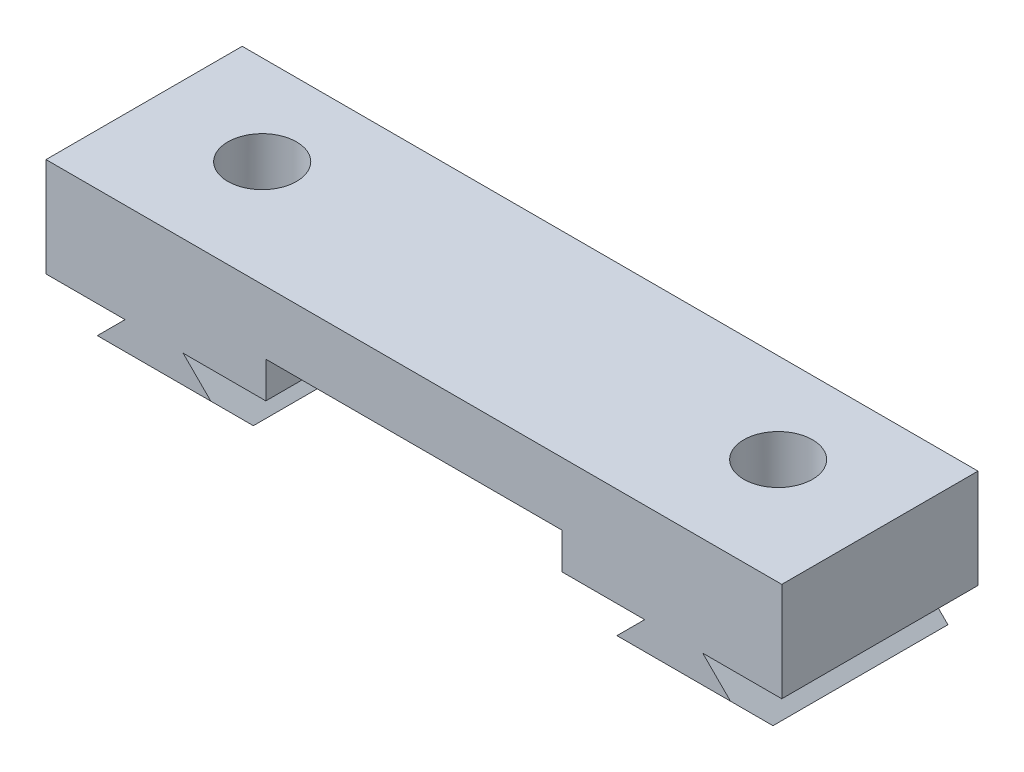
SolidWorks part; units mm, degrees
ref_plane "Front Plane" through (0, 0, 0) normal (0, 0, 1) x (1, 0, 0)
ref_plane "Top Plane" through (0, 0, 0) normal (0, 1, 0) x (1, 0, 0)
ref_plane "Right Plane" through (0, 0, 0) normal (1, 0, 0) x (0, 0, -1)
sketch "Sketch1" plane through (0, 0, 0) normal (0, 1, 0) x (1, 0, 0)
  line L0 (9.0549, 62.1087) -> (22.5, 62.1087) construction
  line L1 (-22.5, -77.5) -> (22.5, -77.5)
  line L2 (-22.5, -77.5) -> (-22.5, 77.5)
  line L3 (-22.5, 77.5) -> (22.5, 77.5)
  line L4 (22.5, -77.5) -> (22.5, 77.5)
  line L5 (-22.5, -77.5) -> (22.5, 77.5) construction
  line L6 (-22.5, 77.5) -> (22.5, -77.5) construction
  line L7 (-9.0549, -71) -> (9.0549, -71)
  line L8 (-9.0549, -71) -> (-9.0549, 71)
  line L9 (-9.0549, 71) -> (9.0549, 71)
  line L10 (9.0549, -71) -> (9.0549, 71)
  line L11 (-9.0549, -71) -> (9.0549, 71) construction
  line L12 (-9.0549, 71) -> (9.0549, -71) construction
  line L13 (22.5, 0) -> (30.5303, 0) construction
  line L14 (0, 71) -> (0, 63.7491) construction
  circle A0 centre (15.7774, 71) radius 2.1
  circle A1 centre (15.7774, -71) radius 2.1
  circle A2 centre (-15.7774, -71) radius 2.1
  circle A3 centre (-15.7774, 71) radius 2.1
  point P0 (0, 0)
  point P6 (0, 0)
  dimension "D4" = 4.2
  dimension "D1" = 45
  dimension "D2" = 155
  dimension "D3" = 142
extrude "Boss-Extrude1" add sketch "Sketch1" along normal blind 3.85
sketch "Sketch2" plane through (22.5, 0, 0) normal (1, 0, 0) x (0, 0, -1)
  line L0 (0, -36.15) -> (0, -37.8485) construction
  line L1 (0, -32.15) -> (-8.9497, -32.15) construction
  line L2 (-60.5001, -2.2123) -> (-12.3944, -2.2123) construction
  line L3 (-60.5001, -0.1123) -> (-12.3944, -0.1123)
  line L4 (-60.5001, -4.3123) -> (-12.3944, -4.3123)
  line L5 (0, 3.85) -> (0, 7.9942) construction
  line L6 (-77.5, 3.85) -> (77.5, 3.85) construction
  line L7 (60.5001, -2.2123) -> (12.3944, -2.2123) construction
  line L8 (60.5001, -0.1123) -> (12.3944, -0.1123)
  line L9 (60.5001, -4.3123) -> (12.3944, -4.3123)
  line L10 (61.6288, -8.735) -> (56.4489, -13.9148)
  line L11 (-10.743, -8.735) -> (-32.1809, -8.735)
  line L12 (-32.1809, -8.735) -> (-15.8727, -25.0432)
  line L13 (-36.07, -8.735) -> (-18.3961, -26.4088)
  line L14 (-18.3961, -26.4088) -> (-36.07, -26.4088)
  line L15 (-36.07, -26.4088) -> (-36.07, -8.735)
  line L16 (-38.82, -8.735) -> (-38.82, -19.7248)
  line L17 (-38.82, -19.7248) -> (-49.8099, -8.735)
  line L18 (-49.8099, -8.735) -> (-38.82, -8.735)
  line L19 (-53.6989, -8.735) -> (-44.5827, -17.8512)
  line L20 (-44.5827, -17.8512) -> (-53.6989, -17.8512)
  line L21 (-53.6989, -17.8512) -> (-53.6989, -8.735)
  line L22 (-56.4489, -13.9148) -> (-56.4489, -8.735)
  line L23 (-56.4489, -8.735) -> (-61.6288, -8.735)
  line L24 (-61.6288, -8.735) -> (-56.4489, -13.9148)
  line L25 (-32.1809, -8.735) -> (-80.3886, -8.735) construction
  line L26 (56.4489, -13.9148) -> (56.4489, -8.735)
  line L27 (53.6989, -17.8512) -> (53.6989, -8.735)
  line L28 (44.5827, -17.8512) -> (53.6989, -17.8512)
  line L29 (53.6989, -8.735) -> (44.5827, -17.8512)
  line L30 (49.8099, -8.735) -> (38.82, -8.735)
  line L31 (38.82, -19.7248) -> (49.8099, -8.735)
  line L32 (38.82, -8.735) -> (38.82, -19.7248)
  line L33 (36.07, -26.4088) -> (36.07, -8.735)
  line L34 (18.3961, -26.4088) -> (36.07, -26.4088)
  line L35 (36.07, -8.735) -> (18.3961, -26.4088)
  line L36 (32.1809, -8.735) -> (15.8727, -25.0432)
  line L37 (10.743, -8.735) -> (32.1809, -8.735)
  line L38 (56.4489, -8.735) -> (61.6288, -8.735)
  circle A0 centre (0, -21.075) radius 11.075
  circle A1 centre (0, -2.2123) radius 2.1
  arc A2 (-60.5001, -0.1123) -> (-60.5001, -4.3123) centre (-60.5001, -2.2123) ccw
  arc A3 (-12.3944, -4.3123) -> (-12.3944, -0.1123) centre (-12.3944, -2.2123) ccw
  arc A4 (60.5001, -0.1123) -> (60.5001, -4.3123) centre (60.5001, -2.2123) cw
  arc A5 (12.3944, -4.3123) -> (12.3944, -0.1123) centre (12.3944, -2.2123) cw
  arc A6 (-10.743, -8.735) -> (-15.8727, -25.0432) centre (0, -21.075) ccw
  arc A7 (10.743, -8.735) -> (15.8727, -25.0432) centre (0, -21.075) cw
  spline S0 degree 3 poles (0, -36.15) (-57.8718, -36.025) (-77.0889, -10.6303) (-77.5, 0) knots 0 0 0 0 1 1 1 1
  spline S1 degree 3 poles (0, -36.15) (57.8718, -36.025) (77.0889, -10.6303) (77.5, 0) knots 0 0 0 0 1 1 1 1
  point P14 (-36.4473, -2.2123)
  point P25 (36.4473, -2.2123)
  dimension "D1" = 22.15
  dimension "D2" = 4.2
  dimension "D4" = 2.1
  dimension "D3" = 4
  dimension "D5" = 45
  dimension "D6" = 45
  dimension "D7" = 45
  dimension "D8" = 2.75
  dimension "D9" = 2.75
  dimension "D10" = 2.75
  dimension "D11" = 2.75
  dimension "D12" = 40
extrude "Boss-Extrude2" add sketch "Sketch2" against normal up to surface (31.5549 mm away) contours S0 S1 L11 A6 L12 L9 A5 L8 A4 L26 L38 L10 L20 L21 L19 L17 L18 L16 L14 L15 L13 L24 L23 L22 L29 L27 L28 L32 L30 L31 L35 L33 L34 A0 A1 A3 L4 M16
mirror "Mirror9" about plane through (0, 0, 0) normal (1, 0, 0) of "Boss-Extrude2"
sketch "Sketch4" plane through (0, 0, 0) normal (0, 1, 0) x (1, 0, 0)
  line L1 (9.0549, 71) -> (-9.0549, 71)
  line L2 (9.0549, 71) -> (9.0549, -71)
  line L3 (9.0549, -71) -> (-9.0549, -71)
  line L4 (-9.0549, 71) -> (-9.0549, -71)
  circle A0 centre (15.7774, -71) radius 2.1
  circle A1 centre (-15.7774, -71) radius 2.1
  circle A2 centre (15.7774, 71) radius 2.1
  circle A3 centre (-15.7774, 71) radius 2.1
extrude "Cut-Extrude1" cut sketch "Sketch4" against normal through all
sketch "Sketch5" plane through (0, 0, 77.5) normal (0, 0, 1) x (1, 0, 0)
  line L0 (-22.5, 0) -> (22.5, 0) construction
  line L1 (-9.0549, -13.0689) -> (9.0549, -13.0689)
  line L2 (-9.0549, -13.0689) -> (-9.0549, 0)
  line L3 (-9.0549, 0) -> (9.0549, 0)
  line L4 (9.0549, -13.0689) -> (9.0549, 0)
extrude "Cut-Extrude2" cut sketch "Sketch5" against normal through all
sketch "Sketch6" plane through (22.5, 0, 0) normal (1, 0, 0) x (0, 0, -1)
  line L0 (-60.5001, -2.2123) -> (-12.3944, -2.2123) construction
  line L1 (-60.5001, 1.3877) -> (-12.3944, 1.3877)
  line L2 (-60.5001, -5.8123) -> (-12.3944, -5.8123)
  line L3 (0, -0.1123) -> (0, -1.2356) construction
  line L4 (60.5001, -2.2123) -> (12.3944, -2.2123) construction
  line L5 (60.5001, 1.3877) -> (12.3944, 1.3877)
  line L6 (60.5001, -5.8123) -> (12.3944, -5.8123)
  arc A0 (-60.5001, 1.3877) -> (-60.5001, -5.8123) centre (-60.5001, -2.2123) ccw
  arc A1 (-12.3944, -5.8123) -> (-12.3944, 1.3877) centre (-12.3944, -2.2123) ccw
  circle A2 centre (0, -2.2123) radius 2.1 construction
  arc A3 (60.5001, 1.3877) -> (60.5001, -5.8123) centre (60.5001, -2.2123) cw
  arc A4 (12.3944, -5.8123) -> (12.3944, 1.3877) centre (12.3944, -2.2123) cw
  point P4 (-36.4473, -2.2123)
  point P16 (36.4473, -2.2123)
  dimension "D1" = 3.6
extrude "Cut-Extrude3" cut sketch "Sketch6" against normal blind 3.5
ref_plane "Plane1" through (0, -35, 0) normal (0, -1, 0) x (-1, 0, 0)
ref_plane "Plane2" through (0, -1.15, 0) normal (0, 1, 0) x (1, 0, 0)
mirror "Mirror10" about plane through (0, 0, 0) normal (1, 0, 0) of "Cut-Extrude3"
sketch "Sketch11" plane through (0, -35, 0) normal (0, -1, 0) x (-1, 0, 0)
  line L0 (0, 77.5) -> (0, 63.1693) construction
  line L1 (15.7774, 75.1569) -> (12.1774, 73.0785)
  line L2 (12.1774, 73.0785) -> (12.1774, 68.9215)
  line L3 (12.1774, 68.9215) -> (15.7774, 66.8431)
  line L4 (15.7774, 66.8431) -> (19.3774, 68.9215)
  line L5 (19.3774, 68.9215) -> (19.3774, 73.0785)
  line L6 (19.3774, 73.0785) -> (15.7774, 75.1569)
  line L7 (-9.0549, 77.5) -> (9.0549, 77.5) construction
  line L8 (-19.3774, 73.0785) -> (-15.7774, 75.1569)
  line L9 (-19.3774, 68.9215) -> (-19.3774, 73.0785)
  line L10 (-15.7774, 66.8431) -> (-19.3774, 68.9215)
  line L11 (-12.1774, 68.9215) -> (-15.7774, 66.8431)
  line L12 (-12.1774, 73.0785) -> (-12.1774, 68.9215)
  line L13 (-15.7774, 75.1569) -> (-12.1774, 73.0785)
  line L14 (-9.0549, 0) -> (-3.8252, 0) construction
  line L15 (-15.7774, -75.1569) -> (-12.1774, -73.0785)
  line L16 (-12.1774, -73.0785) -> (-12.1774, -68.9215)
  line L17 (-12.1774, -68.9215) -> (-15.7774, -66.8431)
  line L18 (-15.7774, -66.8431) -> (-19.3774, -68.9215)
  line L19 (-19.3774, -68.9215) -> (-19.3774, -73.0785)
  line L20 (-19.3774, -73.0785) -> (-15.7774, -75.1569)
  line L21 (19.3774, -73.0785) -> (15.7774, -75.1569)
  line L22 (19.3774, -68.9215) -> (19.3774, -73.0785)
  line L23 (15.7774, -66.8431) -> (19.3774, -68.9215)
  line L24 (12.1774, -68.9215) -> (15.7774, -66.8431)
  line L25 (12.1774, -73.0785) -> (12.1774, -68.9215)
  line L26 (15.7774, -75.1569) -> (12.1774, -73.0785)
  circle A0 centre (15.7774, 71) radius 3.6 construction
  dimension "D1" = 7.2
extrude "Cut-Extrude5" cut sketch "Sketch11" against normal blind 23
sketch "Sketch12" plane through (0, -12, 0) normal (0, -1, 0) x (1, 0, 0)
  line L1 (-15.7774, 66.8431) -> (-12.1774, 68.9215)
  line L2 (-12.1774, 68.9215) -> (-12.1774, 73.0785)
  line L3 (-12.1774, 73.0785) -> (-15.7774, 75.1569)
  line L4 (-15.7774, 75.1569) -> (-19.3774, 73.0785)
  line L5 (-19.3774, 73.0785) -> (-19.3774, 68.9215)
  line L6 (-19.3774, 68.9215) -> (-15.7774, 66.8431)
  line L7 (15.7774, 66.8431) -> (19.3774, 68.9215)
  line L8 (19.3774, 68.9215) -> (19.3774, 73.0785)
  line L9 (19.3774, 73.0785) -> (15.7774, 75.1569)
  line L10 (15.7774, 75.1569) -> (12.1774, 73.0785)
  line L11 (12.1774, 73.0785) -> (12.1774, 68.9215)
  line L12 (12.1774, 68.9215) -> (15.7774, 66.8431)
  line L13 (-15.7774, -66.8431) -> (-19.3774, -68.9215)
  line L14 (-19.3774, -68.9215) -> (-19.3774, -73.0785)
  line L15 (-19.3774, -73.0785) -> (-15.7774, -75.1569)
  line L16 (-15.7774, -75.1569) -> (-12.1774, -73.0785)
  line L17 (-12.1774, -73.0785) -> (-12.1774, -68.9215)
  line L18 (-12.1774, -68.9215) -> (-15.7774, -66.8431)
  line L19 (15.7774, -66.8431) -> (12.1774, -68.9215)
  line L20 (12.1774, -68.9215) -> (12.1774, -73.0785)
  line L21 (12.1774, -73.0785) -> (15.7774, -75.1569)
  line L22 (15.7774, -75.1569) -> (19.3774, -73.0785)
  line L23 (19.3774, -73.0785) -> (19.3774, -68.9215)
  line L24 (19.3774, -68.9215) -> (15.7774, -66.8431)
  circle A0 centre (-15.7774, 71) radius 3.6 construction
  circle A1 centre (15.7774, 71) radius 3.6 construction
  circle A2 centre (-15.7774, -71) radius 3.6 construction
  circle A3 centre (15.7774, -71) radius 3.6 construction
  circle A4 centre (-15.7774, 71) radius 2.1
  circle A5 centre (15.7774, 71) radius 2.1
  circle A6 centre (15.7774, -71) radius 2.1
  circle A7 centre (-15.7774, -71) radius 2.1
  circle A8 centre (-15.7774, -71) radius 2.1 construction
extrude "Boss-Extrude4" add sketch "Sketch12" against normal blind 5
ref_plane "Plane3" through (14.0549, 0, 0) normal (-1, 0, 0) x (0, 0, 1)
sketch "Sketch14" plane through (14.0549, 0, 0) normal (-1, 0, 0) x (0, 0, 1)
  line L0 (-2.85, -0.5668) -> (-2.85, 4.9946)
  line L1 (-2.85, 4.9946) -> (2.85, 4.9946)
  line L2 (-2.85, -0.5668) -> (-2.85, -3.8577)
  line L3 (-2.85, -3.8577) -> (0, -5.5032)
  line L4 (0, -5.5032) -> (2.85, -3.8577)
  line L5 (2.85, -3.8577) -> (2.85, -0.5668)
  line L6 (2.85, 4.9946) -> (2.85, -0.5668)
  line L7 (0, 1.0786) -> (-2.85, -0.5668)
  line L8 (2.85, -0.5668) -> (0, 1.0786)
extrude "Cut-Extrude6" cut sketch "Sketch14" against normal blind 2.6
mirror "Mirror11" about plane through (0, 0, 0) normal (1, 0, 0) of "Cut-Extrude6"
sketch "Sketch15" plane through (22.5, 0, 0) normal (1, 0, 0) x (0, 0, -1)
  circle A0 centre (0, -2.2123) radius 3.6
extrude "Cut-Extrude7" cut sketch "Sketch15" against normal blind 3
mirror "Mirror12" about plane through (0, 0, 0) normal (1, 0, 0) of "Cut-Extrude7"
sketch "Sketch16" plane through (-22.5, 0, 0) normal (-1, 0, 0) x (0, 0, 1)
  circle A0 centre (0, -21.075) radius 11.075
  circle A1 centre (0, -21.075) radius 5.8
  dimension "D1" = 11.6
extrude "Boss-Extrude5" add sketch "Sketch16" against normal blind 1.75
mirror "Mirror13" about plane through (0, 0, 0) normal (1, 0, 0) of "Boss-Extrude5"
sketch "Sketch17" plane through (9.0549, 0, 0) normal (1, 0, 0) x (0, 0, -1)
  circle A0 centre (0, -21.075) radius 13.9
  dimension "D1" = 27.8
extrude "Cut-Extrude9" cut sketch "Sketch17" along normal blind 4
sketch "Sketch19" plane through (9.0549, 0, 0) normal (-1, 0, 0) x (0, 0, 1)
  line L0 (-77.5, 3.85) -> (77.5, 3.85) construction
  arc A0 (-32.1871, -26.1613) -> (-32.485, -18.077) centre (-21.2404, -21.7103) ccw
  arc A1 (-32.485, -18.077) -> (-32.1871, -26.1613) centre (-38.3696, -22.3415) ccw
  dimension "D1" = 25.5603
  dimension "D2" = 26.1915
extrude "Cut-Extrude10" cut sketch "Sketch19" against normal blind 5
sketch "Sketch20" plane through (14.0549, 0, 0) normal (-1, 0, 0) x (0, 0, 1)
  circle A0 centre (-38.3696, -22.3415) radius 3.3
extrude "Cut-Extrude11" cut sketch "Sketch20" against normal through all
sketch "Sketch22" plane through (22.5, 0, 0) normal (1, 0, 0) x (0, 0, -1)
  line L0 (10.0779, -8.3707) -> (15.7278, -27.7205)
  line L1 (15.7278, -27.7205) -> (43.3492, -26.6496)
  line L2 (43.3492, -26.6496) -> (47.2635, -20.5566)
  line L3 (47.2635, -20.5566) -> (43.3492, -17.4917)
  line L4 (43.3492, -17.4917) -> (52.9133, -7.3367)
  line L5 (52.9133, -7.3367) -> (10.0779, -8.3707)
  circle A0 centre (38.3696, -22.3415) radius 2.1
  circle A1 centre (21.2404, -21.7103) radius 2.1
  dimension "D1" = 4.2
  dimension "D2" = 4.2
extrude "Boss-Extrude6" add sketch "Sketch22" against normal up to surface (8.4451 mm away)
sketch "Sketch23" plane through (9.0549, 0, 0) normal (-1, 0, 0) x (0, 0, 1)
  line L0 (-49.8099, -8.735) -> (-42.3098, -16.235)
  line L3 (-38.82, -15.0881) -> (-38.82, -8.735)
  line L4 (-38.82, -8.735) -> (-49.8099, -8.735)
  line L5 (-36.07, -8.735) -> (-36.07, -15.4476)
  line L6 (-36.07, -8.735) -> (-30.4715, -14.3335)
  line L7 (-32.1809, -8.735) -> (-28.5167, -12.3992)
  line L8 (-32.1809, -8.735) -> (-10.743, -8.735)
  line L9 (-10.743, -8.735) -> (-13.9019, -12.4481)
  line L10 (-13.9019, -12.4481) -> (-13.9023, -12.4482)
  arc A0 (-13.9023, -12.4482) -> (-28.5167, -12.3992) centre (-21.2406, -21.7071) ccw
  arc A1 (-32.4839, -18.0785) -> (-36.07, -15.4476) centre (-38.3696, -22.3415) ccw
  arc A2 (-30.4715, -14.3335) -> (-32.4839, -18.0785) centre (-21.2406, -21.7071) ccw
  arc A3 (-38.82, -15.0881) -> (-42.3098, -16.235) centre (-38.3696, -22.3415) ccw
extrude "Boss-Extrude7" add sketch "Sketch23" against normal blind 7
sketch "Sketch24" plane through (14.0549, 0, 0) normal (-1, 0, 0) x (0, 0, 1)
  circle A0 centre (-21.2406, -21.7071) radius 2.1
  dimension "D1" = 4.2
extrude "Cut-Extrude12" cut sketch "Sketch24" against normal through all
sketch "Sketch25" plane through (-22.5, 0, 0) normal (-1, 0, 0) x (0, 0, 1)
  line L0 (-49.0128, -31.2582) -> (-46.0233, -21.3924) construction
  line L1 (-49.1564, -31.2147) -> (-46.8677, -23.6618)
  line L2 (-38.3696, -22.3415) -> (-42.1319, -34.7574) construction
  line L3 (-49.1564, -31.2147) -> (-46.1668, -21.3489) construction
  line L4 (-34.3224, -35.7096) -> (-32.0338, -28.1567)
  line L5 (-49.1564, -31.2147) -> (-34.3224, -35.7096)
  circle A0 centre (-38.3696, -22.3415) radius 8.6
  dimension "D1" = 17.2
  dimension "D2" = 0.15
extrude "Cut-Extrude13" cut sketch "Sketch25" against normal blind 11 contours A0 L1 L4 M10 | A0 M40 M35 M36 M32 M33 M39 | L1 L5 L4 M10 | A0 M39 M40 | A0 M35 M36
sketch "Sketch26" plane through (-22.5, 0, 0) normal (-1, 0, 0) x (0, 0, 1)
  circle A0 centre (-38.3696, -22.3415) radius 3.45
  dimension "D1" = 6.9
extrude "Cut-Extrude14" cut sketch "Sketch26" against normal blind 20
sketch "Sketch27" plane through (-22.5, 0, 0) normal (-1, 0, 0) x (0, 0, 1)
  line L1 (-36.07, -8.735) -> (-18.3961, -26.4088) construction
  line L2 (-18.3961, -26.4088) -> (-30.7923, -26.4088) construction
  line L3 (-27.233, -26.4088) -> (-18.3961, -26.4088)
  line L4 (-18.3961, -26.4088) -> (-27.233, -17.5719)
  line L5 (-45.7043, -17.8512) -> (-47.7713, -17.8512)
  line L6 (-45.7043, -17.8512) -> (-53.6989, -17.8512) construction
  line L7 (-30.7923, -26.4088) -> (-28.7774, -26.4088)
  line L8 (-36.07, -12.1795) -> (-36.07, -8.735)
  line L9 (-36.07, -14.0547) -> (-36.07, -8.735) construction
  line L10 (-36.07, -8.735) -> (-27.233, -17.5719)
  line L11 (-28.7774, -26.4088) -> (-27.233, -26.4088)
  arc A0 (-30.7923, -26.4088) -> (-45.7043, -17.8512) centre (-38.3696, -22.3415) ccw
  arc A1 (-36.07, -12.1795) -> (-47.7713, -17.8512) centre (-38.3696, -22.3415) ccw
extrude "Boss-Extrude8" add sketch "Sketch27" against normal up to surface (13.4451 mm away)
sketch "Sketch28" plane through (-9.0549, 0, 0) normal (1, 0, 0) x (0, 0, -1)
  circle A0 centre (38.3696, -22.3415) radius 3.45
  circle A1 centre (38.3696, -22.3415) radius 8.6
extrude "Boss-Extrude9" add sketch "Sketch28" against normal up to surface (2.4451 mm away)
ref_plane "Plane4" through (0, 0, 0) normal (0, -1, 0) x (-1, 0, 0)
sketch "Sketch30" plane through (0, 0, 77.5) normal (0, 0, 1) x (1, 0, 0)
  line L0 (9.0549, -3.3067) -> (12.0549, -3.3067)
  line L1 (9.0549, 0) -> (9.0549, -36.15) construction
  line L2 (12.0549, -3.3067) -> (10.0549, -5.3067)
  line L3 (10.0549, -5.3067) -> (21.7246, -5.3067)
  line L4 (15.8897, -5.3067) -> (15.8897, -6.096) construction
  line L5 (9.0549, -3.3067) -> (-9.0549, -3.3067)
  line L6 (0, -3.3067) -> (0, -1.2227) construction
  line L7 (31.7795, -3.3067) -> (31.7795, 7.5471)
  line L8 (22.7246, -3.3067) -> (31.7795, -3.3067)
  line L9 (19.7246, -3.3067) -> (21.7246, -5.3067)
  line L10 (22.7246, -3.3067) -> (19.7246, -3.3067)
  line L11 (-31.7795, 7.5471) -> (31.7795, 7.5471)
  line L12 (-22.7246, -3.3067) -> (-19.7246, -3.3067)
  line L13 (-19.7246, -3.3067) -> (-21.7246, -5.3067)
  line L14 (-22.7246, -3.3067) -> (-31.7795, -3.3067)
  line L15 (-31.7795, -3.3067) -> (-31.7795, 7.5471)
  line L16 (-10.0549, -5.3067) -> (-21.7246, -5.3067)
  line L17 (-12.0549, -3.3067) -> (-10.0549, -5.3067)
  line L18 (-9.0549, -3.3067) -> (-12.0549, -3.3067)
  point P18 (0, 7.5471)
  dimension "D1" = 3
  dimension "D2" = 45
  dimension "D3" = 2
extrude "Cut-Extrude16" cut sketch "Sketch30" against normal blind 12 flip side to cut
sketch "Sketch32" plane through (-22.5, 0, 0) normal (-1, 0, 0) x (0, 0, 1)
  line L1 (65.5, 7.5855) -> (-98.8216, 7.5855)
  line L2 (65.5, 7.5855) -> (65.5, -48.2794)
  line L3 (65.5, -48.2794) -> (-98.8216, -48.2794)
  line L4 (-98.8216, 7.5855) -> (-98.8216, -48.2794)
extrude "Cut-Extrude18" cut sketch "Sketch32" against normal through all
sketch "Sketch35" plane through (0, 0, 65.5) normal (0, 0, -1) x (-1, 0, 0)
  line L16 (9.0549, 3.85) -> (9.0549, -3.3067)
  line L17 (9.0549, -3.3067) -> (12.0549, -3.3067)
  line L18 (12.0549, -3.3067) -> (10.0549, -5.3067)
  line L19 (10.0549, -5.3067) -> (21.7246, -5.3067)
  line L20 (21.7246, -5.3067) -> (19.7246, -3.3067)
  line L21 (19.7246, -3.3067) -> (22.5, -3.3067)
  line L22 (22.5, -3.3067) -> (22.5, 3.85)
  line L23 (22.5, 3.85) -> (9.0549, 3.85)
  line L24 (9.0549, 3.85) -> (9.0549, -3.3067)
  line L25 (9.0549, -3.3067) -> (12.0549, -3.3067)
  line L26 (12.0549, -3.3067) -> (10.0549, -5.3067)
  line L27 (10.0549, -5.3067) -> (21.7246, -5.3067)
  line L28 (21.7246, -5.3067) -> (19.7246, -3.3067)
  line L29 (19.7246, -3.3067) -> (22.5, -3.3067)
  line L30 (22.5, -3.3067) -> (22.5, 3.85)
  line L31 (22.5, 3.85) -> (9.0549, 3.85)
  line L40 (-22.5, 3.85) -> (-22.5, -3.3067)
  line L41 (-22.5, -3.3067) -> (-19.7246, -3.3067)
  line L42 (-19.7246, -3.3067) -> (-21.7246, -5.3067)
  line L43 (-21.7246, -5.3067) -> (-10.0549, -5.3067)
  line L44 (-10.0549, -5.3067) -> (-12.0549, -3.3067)
  line L45 (-12.0549, -3.3067) -> (-9.0549, -3.3067)
  line L46 (-9.0549, -3.3067) -> (-9.0549, 3.85)
  line L47 (-9.0549, 3.85) -> (-22.5, 3.85)
  line L48 (-22.5, 3.85) -> (-22.5, -3.3067)
  line L49 (-22.5, -3.3067) -> (-19.7246, -3.3067)
  line L50 (-19.7246, -3.3067) -> (-21.7246, -5.3067)
  line L51 (-21.7246, -5.3067) -> (-10.0549, -5.3067)
  line L52 (-10.0549, -5.3067) -> (-12.0549, -3.3067)
  line L53 (-12.0549, -3.3067) -> (-9.0549, -3.3067)
  line L54 (-9.0549, -3.3067) -> (-9.0549, 3.85)
  line L55 (-9.0549, 3.85) -> (-22.5, 3.85)
  dimension "D1" = 0
  dimension "D2" = 0
extrude "Boss-Extrude10" add sketch "Sketch35" against normal blind 3
pattern_linear "LPattern1" count 2 spacing 9 of "Boss-Extrude10"
chamfer "Chamfer1" distance 1.4 angle 45 2 edges at (15.8897, -5.3067, 77.5) (-15.8897, -5.3067, 77.5)
sketch "Sketch36" plane through (0, 0, 77.5) normal (0, 0, 1) x (1, 0, 0)
  line L0 (-21.1147, -5.3067) -> (-18.168, -2.36)
  line L1 (-10.0549, -5.3067) -> (-21.7246, -5.3067) construction
  line L2 (-18.168, -2.36) -> (-22.5, -2.36)
  line L3 (-22.5, 3.85) -> (-22.5, -3.3067) construction
  line L4 (-22.5, -2.36) -> (-25.8641, -2.36)
  line L5 (-25.8641, -2.36) -> (-20.2954, -8.4896)
  line L6 (-20.2954, -8.4896) -> (-15.8897, -5.3067)
  line L7 (-10.6647, -5.3067) -> (-21.1147, -5.3067)
  line L8 (-22.5, 3.85) -> (22.5, 3.85) construction
  line L9 (-15.8897, -5.3067) -> (-15.8897, -4.0106) construction
  line L10 (-11.4841, -8.4896) -> (-15.8897, -5.3067)
  line L11 (-5.9153, -2.36) -> (-11.4841, -8.4896)
  line L12 (-9.2795, -2.36) -> (-5.9153, -2.36)
  line L13 (-13.6114, -2.36) -> (-9.2795, -2.36)
  line L14 (-10.6647, -5.3067) -> (-13.6114, -2.36)
  line L15 (0, 0) -> (0, -2.36) construction
  line L16 (10.6647, -5.3067) -> (13.6114, -2.36)
  line L17 (13.6114, -2.36) -> (9.2795, -2.36)
  line L18 (9.2795, -2.36) -> (5.9153, -2.36)
  line L19 (5.9153, -2.36) -> (11.4841, -8.4896)
  line L20 (11.4841, -8.4896) -> (15.8897, -5.3067)
  line L21 (10.6647, -5.3067) -> (21.1147, -5.3067)
  line L22 (20.2954, -8.4896) -> (15.8897, -5.3067)
  line L23 (25.8641, -2.36) -> (20.2954, -8.4896)
  line L24 (22.5, -2.36) -> (25.8641, -2.36)
  line L25 (18.168, -2.36) -> (22.5, -2.36)
  line L26 (21.1147, -5.3067) -> (18.168, -2.36)
  dimension "D1" = 5.225
  dimension "D2" = 45
  dimension "D3" = 6.21
extrude "Cut-Extrude19" cut sketch "Sketch36" against normal through all contours L6 L7 L0 L4 L5 M13 M12 M11 M10 | L14 L7 L10 L11 L12 M16 M15 M14 M13 | L14 L12 L13 M13 M14 M15 M16 | L0 L2 M10 M11 M12 M13 | L17 L18 L16 M18 M19 M4 M5 | L21 L16 L18 L19 L20 M5 M4 M19 M18 | L26 L21 L22 L23 L24 M8 M7 M6 M5 | L26 L25 M5 M6 M7 M8
sketch "Sketch37" plane through (0, 3.85, 0) normal (0, 1, 0) x (1, 0, 0)
  line L1 (-9.0549, -65.5) -> (9.0549, -65.5)
  line L2 (-9.0549, -65.5) -> (-9.0549, -71)
  line L3 (-9.0549, -71) -> (9.0549, -71)
  line L4 (9.0549, -65.5) -> (9.0549, -71)
extrude "Boss-Extrude11" add sketch "Sketch37" against normal up to surface (3.85 mm away)
sketch "Sketch38" plane through (0, 0, 77.5) normal (0, 0, 1) x (1, 0, 0)
  line L16 (-23.4647, -2.21) -> (-23.4647, -7.2506)
  line L17 (-23.4647, -7.2506) -> (-5.8971, -7.2506)
  line L18 (-5.8971, -7.2506) -> (-7.3636, -2.21)
  line L19 (-7.3636, -2.21) -> (-9.2049, -2.21)
  line L20 (-9.2049, -2.21) -> (-9.2161, -2.218)
  line L21 (-22.35, -2.21) -> (-23.4647, -2.21)
  line L22 (0, 0) -> (0, -1.0139) construction
  line L23 (13.9736, -2.21) -> (9.2049, -2.21)
  line L24 (12.4269, -3.7567) -> (13.9736, -2.21)
  line L25 (17.8059, -2.21) -> (19.3526, -3.7567)
  line L26 (22.35, -2.21) -> (17.8059, -2.21)
  line L27 (21.2995, -5.7035) -> (10.3168, -5.8668)
  line L28 (12.4269, -3.7567) -> (10.3168, -5.8668)
  line L29 (19.3526, -3.7567) -> (21.2995, -5.7035)
  line L30 (22.35, -2.21) -> (23.4647, -2.21)
  line L31 (9.2049, -2.21) -> (9.2161, -2.218)
  line L32 (7.3636, -2.21) -> (9.2049, -2.21)
  line L33 (5.8971, -7.2506) -> (7.3636, -2.21)
  line L34 (-19.3526, -3.7567) -> (-21.2995, -5.7035)
  line L35 (-12.4269, -3.7567) -> (-10.3168, -5.8668)
  line L36 (-21.2995, -5.7035) -> (-10.3168, -5.8668)
  line L37 (23.4647, -7.2506) -> (5.8971, -7.2506)
  line L38 (23.4647, -2.21) -> (23.4647, -7.2506)
  line L52 (-22.35, -2.21) -> (-17.8059, -2.21)
  line L53 (-17.8059, -2.21) -> (-19.3526, -3.7567)
  line L55 (-12.4269, -3.7567) -> (-13.9736, -2.21)
  line L56 (-13.9736, -2.21) -> (-9.2049, -2.21)
extrude "Cut-Extrude20" cut sketch "Sketch38" against normal through all
sketch "Sketch39" plane through (0, 0, 77.5) normal (0, 0, 1) x (1, 0, 0)
  line L1 (-22.5, -2.21) -> (-17.6645, -2.21)
  line L2 (-17.6645, -2.21) -> (-20.6612, -5.2067)
  line L3 (-20.6612, -5.2067) -> (-11.1183, -5.2067)
  line L4 (22.7872, -6.9731) -> (22.5, -2.21)
  line L5 (-10.8769, -5.3067) -> (-20.9026, -5.3067) construction
  line L6 (-14.115, -2.21) -> (-11.1183, -5.2067)
  line L7 (-14.115, -2.21) -> (-8.5901, -2.21)
  line L8 (0, 0) -> (0, -1.4063) construction
  line L9 (-8.5901, -2.21) -> (-8.3742, -7.8458)
  line L10 (-8.3742, -7.8458) -> (-22.7872, -6.9731)
  line L11 (-22.7872, -6.9731) -> (-22.5, -2.21)
  line L14 (-17.8059, -2.21) -> (-19.5026, -3.9067) construction
  line L15 (8.3742, -7.8458) -> (22.7872, -6.9731)
  line L16 (8.5901, -2.21) -> (8.3742, -7.8458)
  line L17 (14.115, -2.21) -> (8.5901, -2.21)
  line L18 (14.115, -2.21) -> (11.1183, -5.2067)
  line L19 (20.6612, -5.2067) -> (11.1183, -5.2067)
  line L20 (17.6645, -2.21) -> (20.6612, -5.2067)
  line L21 (22.5, -2.21) -> (17.6645, -2.21)
  point P1 (15.8897, -5.2067)
  point P10 (-15.8897, -5.2067)
  dimension "D1" = 0.1
  dimension "D2" = 0.1
extrude "Cut-Extrude21" cut sketch "Sketch39" against normal through all
